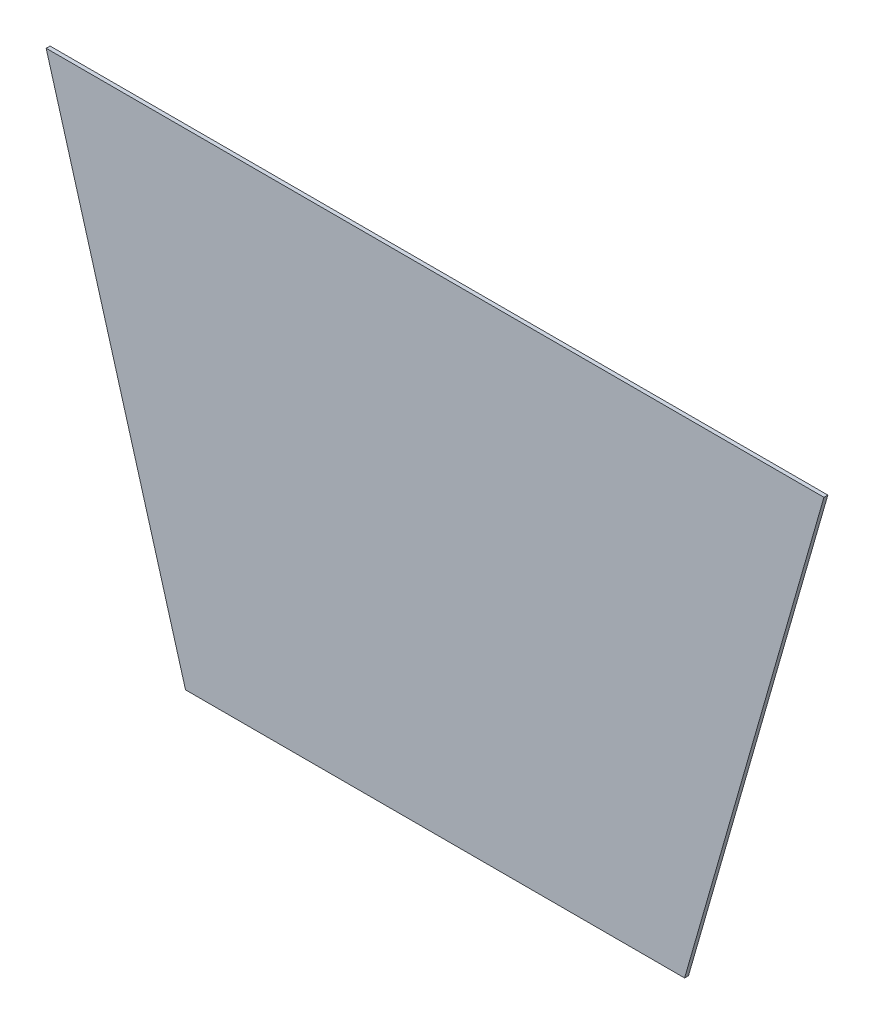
SolidWorks part; units mm, degrees
ref_plane "前视基准面" through (0, 0, 0) normal (0, 0, 1) x (1, 0, 0)
ref_plane "上视基准面" through (0, 0, 0) normal (0, 1, 0) x (1, 0, 0)
ref_plane "右视基准面" through (0, 0, 0) normal (1, 0, 0) x (0, 0, -1)
sketch "草图1" plane through (0, 0, 0) normal (0, 0, 1) x (1, 0, 0)
  line L0 (-192.5, 0) -> (192.5, 0)
  line L1 (0, 0) -> (0, 374.8917) construction
  line L2 (-300, 374.8917) -> (300, 374.8917)
  line L3 (-300, 374.8917) -> (-192.5, 0)
  line L4 (300, 374.8917) -> (192.5, 0)
  dimension "D1" = 385
  dimension "D2" = 600
  dimension "D3" = 390
extrude "凸台-拉伸1" add sketch "草图1" along normal blind 3
